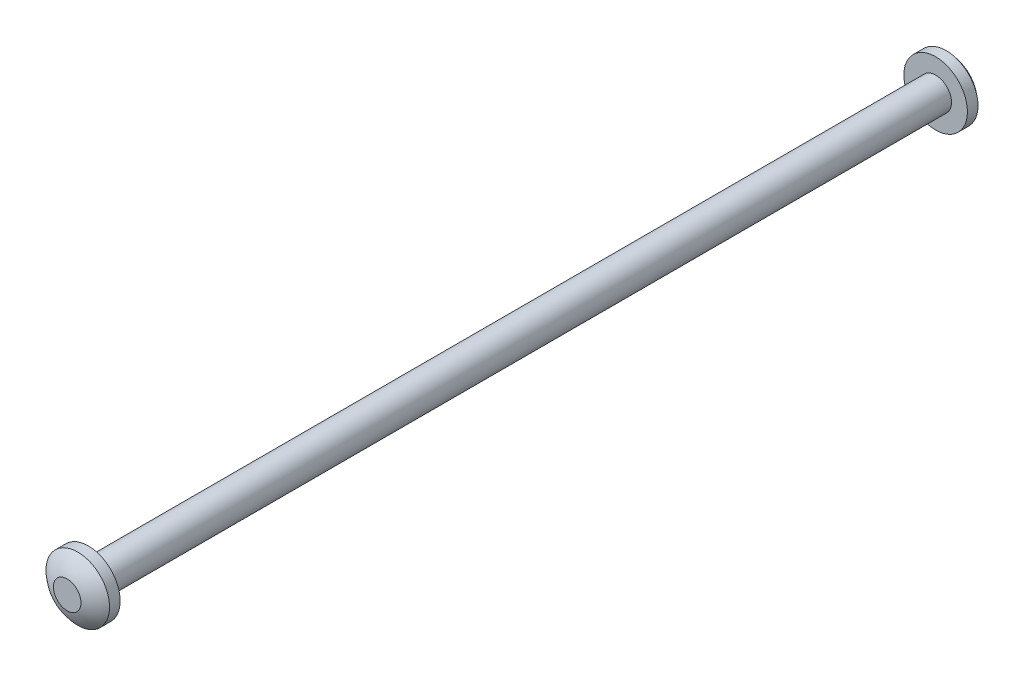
SolidWorks part; units mm, degrees
ref_plane "Front Plane" through (0, 0, 0) normal (0, 0, 1) x (1, 0, 0)
ref_plane "Top Plane" through (0, 0, 0) normal (0, 1, 0) x (1, 0, 0)
ref_plane "Right Plane" through (0, 0, 0) normal (1, 0, 0) x (0, 0, -1)
sketch "Sketch1" plane through (0, 0, 0) normal (0, 0, 1) x (1, 0, 0)
  circle A0 centre (0, 0) radius 1.1906
  dimension "D1" = 2.3813
extrude "Boss-Extrude1" add sketch "Sketch1" against normal blind 63.5
ref_plane "Plane1" through (0, 0, -31.75) normal (0, 0, 1) x (1, 0, 0)
sketch "Sketch2" plane through (0, 0, 0) normal (0, 0, 1) x (1, 0, 0)
  circle A0 centre (0, 0) radius 2.3812
  dimension "D1" = 4.7625
extrude "Boss-Extrude2" add sketch "Sketch2" along normal blind 0.7937
sketch "Sketch6" plane through (0, 0, 0) normal (1, 0, 0) x (0, 0, -1)
  line L0 (-0.7937, 2.3812) -> (-0.7937, -2.3812) construction
  line L1 (-0.7937, 2.3812) -> (-0.7937, -2.3812)
  line L2 (-1.5875, 1.0349) -> (-1.5875, -1.0349)
  line L3 (-0.7937, 0) -> (-1.7462, 0)
  arc A0 (-0.7937, 2.3812) -> (-0.7937, -2.3812) centre (1.7066, 0) ccw
  point P3 (-1.7463, 0)
  dimension "D1" = 0.9525
  dimension "D2" = 0.7937
revolve "Revolve1" add sketch "Sketch6" angle 360 about L3
mirror "Mirror1" about plane through (0, 0, -31.75) normal (0, 0, 1) of "Boss-Extrude2", "Revolve1"
